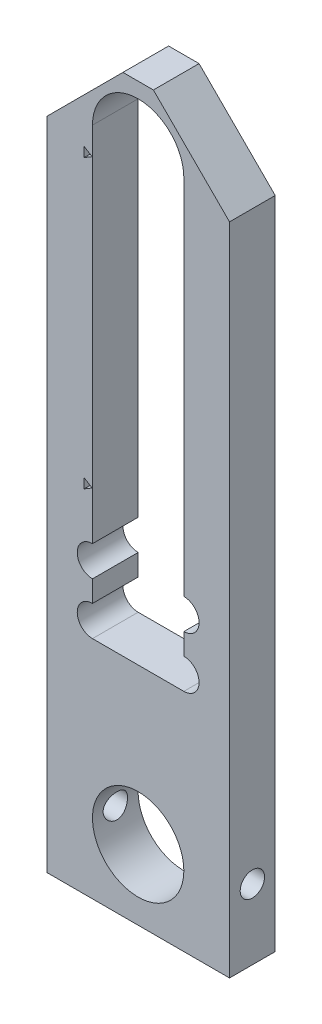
SolidWorks part; units mm, degrees
ref_plane "Plan1" through (0, 0, 0) normal (0, 0, 1) x (1, 0, 0)
ref_plane "Plan2" through (0, 0, 0) normal (0, 1, 0) x (1, 0, 0)
ref_plane "Plan3" through (0, 0, 0) normal (1, 0, 0) x (0, 0, -1)
sketch "Esquisse1" plane through (0, 0, 0) normal (0, 0, 1) x (1, 0, 0)
  line L0 (0, 215) -> (25, 240)
  line L1 (0, 0) -> (60, 0)
  line L2 (0, 0) -> (0, 215)
  line L3 (25, 240) -> (35, 240)
  line L4 (60, 0) -> (60, 215)
  line L5 (35, 240) -> (60, 215)
extrude "Base-Extrusion" add sketch "Esquisse1" along normal blind 15
sketch "Esquisse2" plane through (0, 0, 15) normal (0, 0, 1) x (1, 0, 0)
  circle A0 centre (30, 23) radius 15
extrude "Enlèv. mat.-Extru.1" cut sketch "Esquisse2" against normal blind 15
sketch "Esquisse3" plane through (0, 0, 15) normal (0, 0, 1) x (1, 0, 0)
  line L0 (45, 91) -> (45, 84)
  line L1 (15, 91) -> (15, 84)
  line L2 (15, 220) -> (15, 101)
  line L3 (15, 74) -> (45, 74)
  line L4 (45, 220) -> (45, 101)
  arc A0 (45, 220) -> (15, 220) centre (30, 220) ccw
  arc A1 (45, 74) -> (45, 84) centre (45, 79) ccw
  arc A2 (15, 84) -> (15, 74) centre (15, 79) ccw
  arc A3 (15, 101) -> (15, 91) centre (15, 96) ccw
  arc A4 (45, 91) -> (45, 101) centre (45, 96) ccw
extrude "Enlèv. mat.-Extru.2" cut sketch "Esquisse3" against normal blind 15
sketch "Esquisse4" plane through (0, 0, 0) normal (-1, 0, 0) x (0, 0, 1)
  circle A0 centre (7.5, 23) radius 4
extrude "Enlèv. mat.-Extru.3" cut sketch "Esquisse4" against normal through all
sketch "Esquisse5" plane through (0, 0, 15) normal (0, 0, 1) x (1, 0, 0)
  line L0 (15, 116.7779) -> (11.5997, 116.7779) construction
  line L1 (15, 220) -> (15, 101) construction
  line L2 (14.9022, 116.7779) -> (12.2393, 118.3779)
  line L3 (12.2393, 118.3779) -> (12.2393, 115.1779)
  line L4 (12.2393, 115.1779) -> (14.9022, 116.7779)
  dimension "D1" = 1.6
  dimension "D2" = 1.6
extrude "Enlèv. mat.-Extru.4" cut sketch "Esquisse5" against normal through all
pattern_linear "Répétition linéaire1" count 2 spacing 94.21
sketch "Esquisse6" plane through (0, 0, 15) normal (0, 0, 1) x (1, 0, 0)
  line L0 (15, 210.9994) -> (12.4109, 210.9994) construction
  line L1 (15, 220) -> (15, 101) construction
  dimension "D1" = 94.2214
